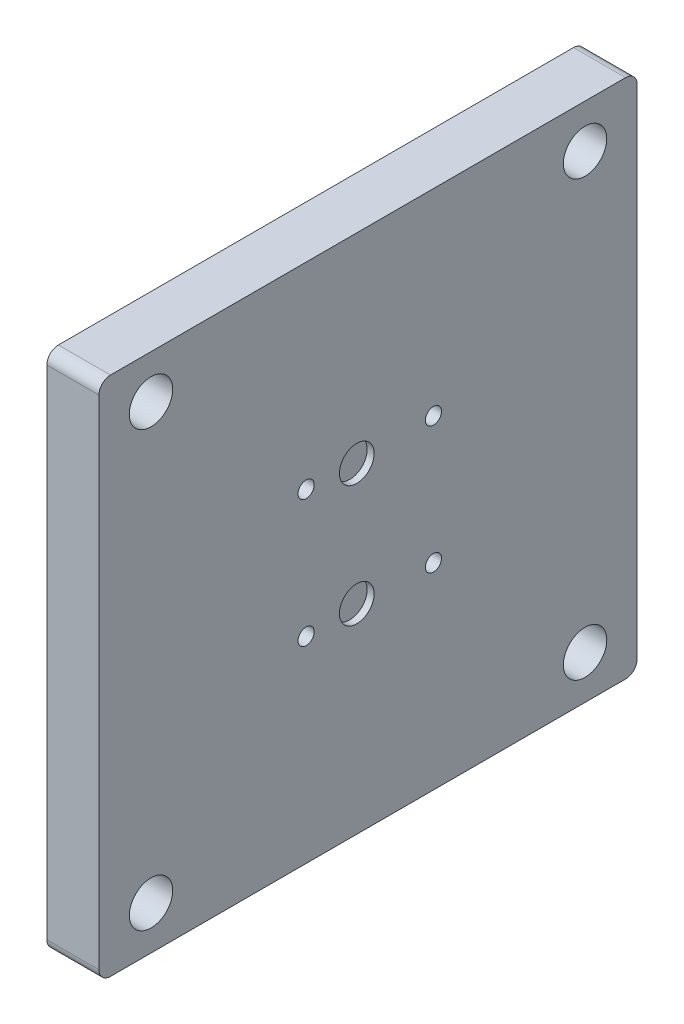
SolidWorks part; units mm, degrees
ref_plane "前视基准面" through (0, 0, 0) normal (0, 0, 1) x (1, 0, 0)
ref_plane "上视基准面" through (0, 0, 0) normal (0, 1, 0) x (1, 0, 0)
ref_plane "右视基准面" through (0, 0, 0) normal (1, 0, 0) x (0, 0, -1)
sketch "草图1" plane through (0, 0, 0) normal (1, 0, 0) x (0, 0, -1)
  line L1 (-46.5, 45) -> (46.5, 45)
  line L2 (-46.5, 45) -> (-46.5, -45)
  line L3 (-46.5, -45) -> (46.5, -45)
  line L4 (46.5, 45) -> (46.5, -45)
  line L5 (-46.5, 45) -> (46.5, -45) construction
  line L6 (-46.5, -45) -> (46.5, 45) construction
  point P0 (0, 0)
  dimension "D1" = 93
  dimension "D2" = 90
extrude "凸台-拉伸1" add sketch "草图1" along normal blind 9
sketch "草图2" plane through (0, 0, 0) normal (-1, 0, 0) x (0, 0, 1)
  line L0 (-25, -25) -> (-25, 25) construction
  line L1 (-26.5, -26.5) -> (26.5, -26.5)
  line L2 (-26.5, -26.5) -> (-26.5, 26.5)
  line L3 (-26.5, 26.5) -> (26.5, 26.5)
  line L4 (26.5, -21.5) -> (26.5, 21.5)
  line L5 (25, -25) -> (-25, -25) construction
  line L6 (-25, 25) -> (25, 25) construction
  line L7 (25, 25) -> (25, -25) construction
  line L8 (46.5, 45) -> (46.5, -45) construction
  line L9 (26.5, -26.5) -> (46.5, -26.5)
  line L11 (26.5, -21.5) -> (46.5, -21.5)
  line L12 (46.5, -26.5) -> (46.5, -21.5)
  line L14 (26.5, 26.5) -> (46.5, 26.5)
  line L16 (26.5, 21.5) -> (46.5, 21.5)
  line L17 (46.5, 26.5) -> (46.5, 21.5)
  dimension "D1" = 1.5
  dimension "D2" = 1.5
  dimension "D3" = 1.5
  dimension "D4" = 1.5
  dimension "D5" = 5
  dimension "D6" = 5
extrude "切除-拉伸1" cut sketch "草图2" against normal blind 2.75
fillet "圆角1" radius 2 4 edges at (4.5, -45, 46.5) (4.5, 45, 46.5) (4.5, 45, -46.5) (4.5, -45, -46.5)
hole_wizard "打孔尺寸(%根据)内六角圆柱头螺钉的类型1" positions "草图4" profile "草图5" counterbore size "M3" standard "GB"
sketch "草图4" plane through (9, 0, 0) normal (1, 0, 0) x (0, 0, -1)
  point P0 (-37.5, 37.5)
  point P2 (37.5, 37.5)
  point P4 (-37.5, -37.5)
  point P6 (37.5, -37.5)
sketch "草图5" plane through (9, 37.5, 37.5) normal (0, 1, 0) x (0, 0, -1)
  line L0 (0, 0) -> (0, 11.0914)
  line L1 (0, 11.0914) -> (1.65, 10.1)
  line L2 (1.65, 10.1) -> (1.65, 6)
  line L3 (1.65, 6) -> (3.75, 6)
  line L4 (3.75, 6) -> (3.75, 0)
  line L5 (3.75, 0) -> (0, 0)
  line L10 (0, 11.0914) -> (-1.65, 10.1) construction
  line L11 (0, -6.35) -> (0, 107.95) construction
  dimension "孔直径" = 3.3
  dimension "孔深度" = 10.1
  dimension "柱形沉头孔直径" = 7.5
  dimension "柱形沉头孔深度" = 6
  dimension "导头角度" = 118
sketch "草图16" plane through (0, 0, 0) normal (-1, 0, 0) x (0, 0, 1)
  circle A0 centre (-26.5, 26.5) radius 2.5
  circle A1 centre (-26.5, -26.5) radius 2.5
  dimension "D1" = 5
extrude "切除-拉伸2" cut sketch "草图16" against normal up to surface (2.75 mm away)
sketch "草图19" plane through (2.75, 0, 0) normal (-1, 0, 0) x (0, 0, 1)
  line L8 (-26.5, 24) -> (-26.5, -24)
  line L9 (-24, -26.5) -> (46.5, -26.5)
  line L10 (46.5, -26.5) -> (46.5, -21.5)
  line L11 (46.5, -21.5) -> (26.5, -21.5)
  line L12 (26.5, -21.5) -> (26.5, 21.5)
  line L13 (26.5, 21.5) -> (46.5, 21.5)
  line L14 (46.5, 21.5) -> (46.5, 26.5)
  line L15 (46.5, 26.5) -> (-24, 26.5)
  line L16 (-26.5, 24) -> (-26.5, -24)
  line L17 (-24, -26.5) -> (46.5, -26.5)
  line L18 (46.5, -26.5) -> (46.5, -21.5)
  line L19 (46.5, -21.5) -> (26.5, -21.5)
  line L20 (26.5, -21.5) -> (26.5, 21.5)
  line L21 (26.5, 21.5) -> (46.5, 21.5)
  line L22 (46.5, 21.5) -> (46.5, 26.5)
  line L23 (46.5, 26.5) -> (-24, 26.5)
  arc A2 (-26.5, -24) -> (-24, -26.5) centre (-26.5, -26.5) ccw
  arc A3 (-24, 26.5) -> (-26.5, 24) centre (-26.5, 26.5) ccw
  arc A4 (-26.5, -24) -> (-24, -26.5) centre (-26.5, -26.5) ccw
  arc A5 (-24, 26.5) -> (-26.5, 24) centre (-26.5, 26.5) ccw
  dimension "D1" = 0
extrude "凸台-拉伸2" add sketch "草图19" along normal up to surface (2.75 mm away)
sketch "草图24" plane through (9, 0, 0) normal (1, 0, 0) x (0, 0, -1)
  circle A0 centre (-1.95, 10.5) radius 3
  circle A1 centre (-1.95, -10.5) radius 3
  dimension "D1" = 6
  dimension "D2" = 6
extrude "切除-拉伸3" cut sketch "草图24" against normal blind 1.2
hole_wizard "打孔尺寸(%根据)内六角圆柱头螺钉的类型2" positions "草图25" profile "草图26" counterbore size "M2.5" standard "GB"
sketch "草图25" plane through (0, 0, 0) normal (-1, 0, 0) x (0, 0, 1)
  point P0 (-11.3, -11)
  point P2 (-11.3, 11)
  point P4 (10.7, -11)
  point P6 (10.7, 11)
sketch "草图26" plane through (0, -11, -11.3) normal (0, 1, 0) x (0, 0, 1)
  line L0 (0, 0) -> (0, 15.8412)
  line L1 (0, 15.8412) -> (1.4, 15)
  line L2 (1.4, 15) -> (1.4, 6)
  line L3 (1.4, 6) -> (3.25, 6)
  line L4 (3.25, 6) -> (3.25, 0)
  line L5 (3.25, 0) -> (0, 0)
  line L10 (0, 15.8412) -> (-1.4, 15) construction
  line L11 (0, -6.35) -> (0, 107.95) construction
  dimension "孔直径" = 2.8
  dimension "孔深度" = 15
  dimension "柱形沉头孔直径" = 6.5
  dimension "柱形沉头孔深度" = 6
  dimension "导头角度" = 118
